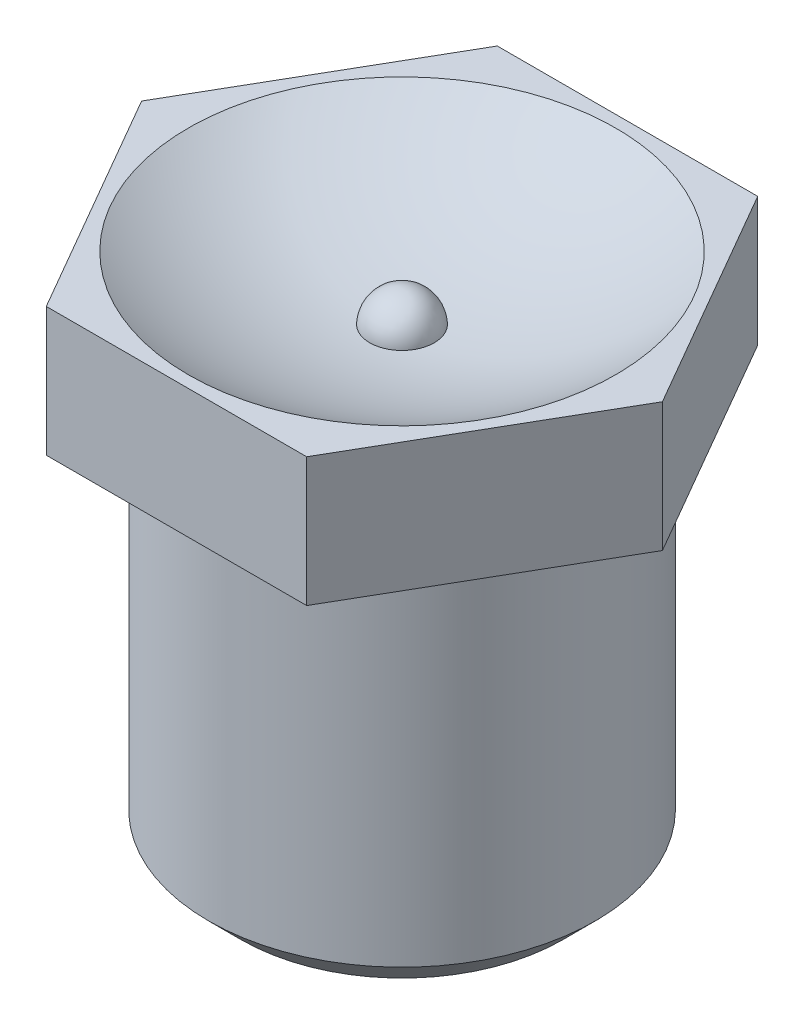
SolidWorks part; units mm, degrees
ref_plane "Plan de face" through (0, 0, 0) normal (0, 0, 1) x (1, 0, 0)
ref_plane "Plan de dessus" through (0, 0, 0) normal (0, 1, 0) x (1, 0, 0)
ref_plane "Plan de droite" through (0, 0, 0) normal (1, 0, 0) x (0, 0, -1)
sketch "Esquisse1" plane through (0, 0, 0) normal (0, 1, 0) x (1, 0, 0)
  circle A0 centre (0, 0) radius 3
  dimension "D1" = 6
extrude "Extrusion1" add sketch "Esquisse1" against normal blind 6
sketch "Esquisse2" plane through (0, 0, 0) normal (0, 1, 0) x (-1, 0, 0)
  line L1 (-2.0207, 3.5) -> (-4.0415, 0)
  line L2 (-4.0415, 0) -> (-2.0207, -3.5)
  line L3 (-2.0207, -3.5) -> (2.0207, -3.5)
  line L4 (2.0207, -3.5) -> (4.0415, 0)
  line L5 (4.0415, 0) -> (2.0207, 3.5)
  line L6 (2.0207, 3.5) -> (-2.0207, 3.5)
  circle A0 centre (0, 0) radius 3.5 construction
  dimension "D1" = 7
extrude "Extrusion2" add sketch "Esquisse2" along normal blind 2
chamfer "Chanfrein1" distance 0.5 angle 45 1 edges at (0, -6, 3)
sketch "Esquisse3" plane through (0, 0, 0) normal (0, 0, 1) x (1, 0, 0)
  line L0 (-7.6121, 7) -> (8.2807, 7) construction
  line L1 (-6, 7) -> (6, 7)
  line L3 (-2.0207, 2) -> (2.0207, 2) construction
  arc A0 (-6, 7) -> (6, 7) centre (0, 7) ccw
  dimension "D1" = 6
  dimension "D2" = 5
revolve "Enlèvement de matière-Révolution1" cut sketch "Esquisse3" angle 360 about L0
sketch "Esquisse4" plane through (0, 0, 0) normal (0, 0, 1) x (1, 0, 0)
  line L0 (-1.5672, 1) -> (1.5672, 1) construction
  line L1 (-0.5, 1) -> (0.5, 1)
  arc A0 (0.5, 1) -> (-0.5, 1) centre (0, 1) ccw
  arc A1 (-3.3166, 2) -> (3.3166, 2) centre (0, 7) ccw construction
  dimension "D1" = 1
revolve "Révolution1" add sketch "Esquisse4" angle 360 about L0
